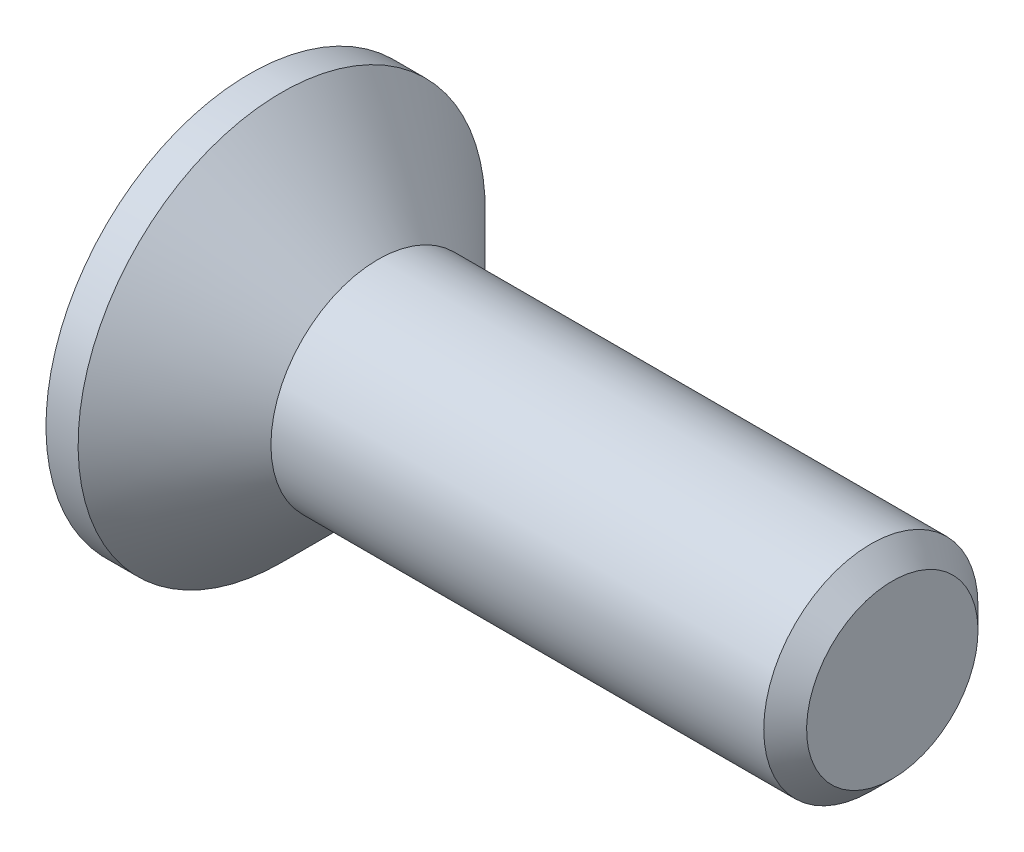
SolidWorks part; units mm, degrees
ref_plane "Front Plane" through (0, 0, 0) normal (0, 0, 1) x (1, 0, 0)
ref_plane "Top Plane" through (0, 0, 0) normal (0, 1, 0) x (1, 0, 0)
ref_plane "Right Plane" through (0, 0, 0) normal (1, 0, 0) x (0, 0, -1)
sketch "Sketch1" plane through (0, 0, 0) normal (0, 0, 1) x (1, 0, 0)
  line L1 (-1.2, 1.9) -> (-1.2, 0)
  line L2 (-1.2, 0) -> (4.8, 0)
  line L3 (4.8, 0) -> (4.8, 1)
  line L4 (4.8, 1) -> (0, 1)
  line L5 (-1.2, 1.9) -> (-0.9, 1.9)
  line L6 (-0.9, 1.9) -> (0, 1)
  dimension "D1" = 1
  dimension "D2" = 45
  dimension "D3" = 1.2
  dimension "D4" = 6
  dimension "D5" = 1.9
revolve "Revolve1" add sketch "Sketch1" angle 360 about L2
chamfer "Chamfer1" distance 0.2 angle 45 1 edges at (4.8, -1, 0)
sketch "Sketch2" plane through (-1.2, 0, 0) normal (-1, 0, 0) x (0, 0, 1)
  line L0 (-0.3, 1.175) -> (0.3, 1.175)
  line L1 (0.3, 1.175) -> (0.3, 0.3)
  line L2 (0.3, 0.3) -> (1.175, 0.3)
  line L3 (1.175, 0.3) -> (1.175, -0.3)
  line L4 (1.175, -0.3) -> (0.3, -0.3)
  line L5 (0.3, -0.3) -> (0.3, -1.175)
  line L6 (0.3, -1.175) -> (-0.3, -1.175)
  line L7 (-0.3, -1.175) -> (-0.3, -0.3)
  line L8 (-0.3, -0.3) -> (-1.175, -0.3)
  line L9 (-1.175, -0.3) -> (-1.175, 0.3)
  line L10 (-1.175, 0.3) -> (-0.3, 0.3)
  line L11 (-0.3, 0.3) -> (-0.3, 1.175)
  point P5 (0, 1.175)
  point P13 (1.175, 0)
  point P15 (-1.175, 0)
  point P16 (0, -1.175)
  point P17 (0.3, 1.085)
  dimension "D1" = 0.6
  dimension "D2" = 2.35
extrude "Cut-Extrude1" cut sketch "Sketch2" against normal blind 0.95
